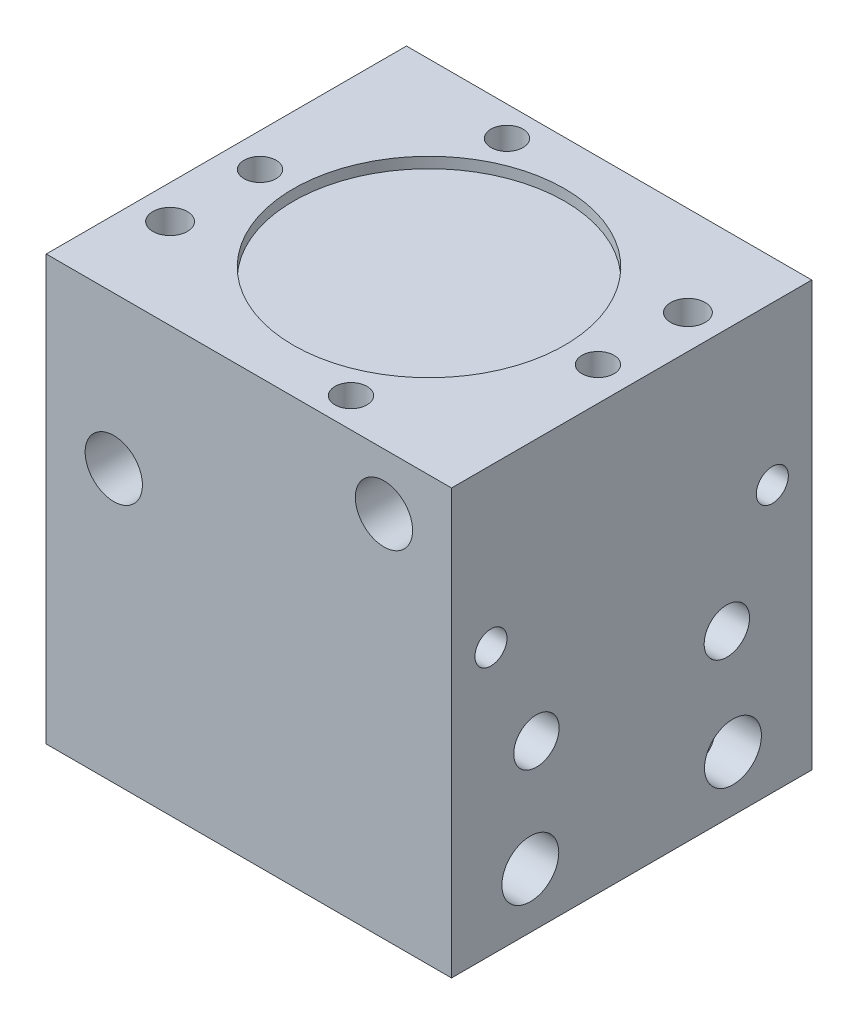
SolidWorks part; units mm, degrees
ref_plane "Front/Back" through (0, 0, 0) normal (0, 0, 1) x (1, 0, 0)
ref_plane "Top/Bottom" through (0, 0, 0) normal (0, 1, 0) x (1, 0, 0)
ref_plane "Right/Left" through (0, 0, 0) normal (1, 0, 0) x (0, 0, -1)
sketch "Sketch1" plane through (0, 0, 0) normal (0, 1, 0) x (1, 0, 0)
  line L0 (0, 0) -> (14.2875, 0) construction
  line L1 (-14.2875, 12.7) -> (14.2875, 12.7)
  line L2 (-14.2875, 12.7) -> (-14.2875, -12.7)
  line L3 (-14.2875, -12.7) -> (14.2875, -12.7)
  line L4 (14.2875, 12.7) -> (14.2875, -12.7)
  line L5 (0, 0) -> (0, 12.7) construction
  dimension "D1" = 28.575
  dimension "D2" = 25.4
extrude "Extrude1" add sketch "Sketch1" along normal mid plane 29.9212
sketch "Sketch2" plane through (0, -14.9606, 0) normal (0, -1, 0) x (1, 0, 0)
  line L0 (0, 0) -> (13.4137, 0) construction
  line L1 (0, 0) -> (0, 15.0178) construction
  line L2 (-11.1252, 6.1831) -> (-11.1252, -6.1831)
  line L3 (9.271, 10.0584) -> (-9.271, 10.0584)
  line L5 (9.271, -10.0584) -> (-9.271, -10.0584)
  line L6 (11.1252, 6.1831) -> (11.1252, -6.1831)
  arc A0 (-9.271, 10.0584) -> (-11.1252, 6.1831) centre (-9.271, 7.6772) ccw
  arc A1 (9.271, 10.0584) -> (11.1252, 6.1831) centre (9.271, 7.6772) cw
  arc A2 (-9.271, -10.0584) -> (-11.1252, -6.1831) centre (-9.271, -7.6772) cw
  arc A3 (9.271, -10.0584) -> (11.1252, -6.1831) centre (9.271, -7.6772) ccw
  dimension "D3" = 4.7625
  dimension "D4" = 20.1168
  dimension "D1" = 22.2504
  dimension "D2" = 1.8542
extrude "Cut-Extrude1" cut sketch "Sketch2" against normal blind 14.0462
sketch "Sketch3" plane through (0, 14.9606, 0) normal (0, 1, 0) x (-1, 0, 0)
  line L0 (0, 0) -> (0, 17.5227) construction
  line L1 (0, 0) -> (15.195, 0) construction
  circle A0 centre (0, 0) radius 9.5631
  dimension "D1" = 19.1262
extrude "Cut-Extrude2" cut sketch "Sketch3" against normal blind 0.762
sketch "Sketch4" plane through (14.2875, 0, 0) normal (1, 0, 0) x (0, 0, -1)
  line L0 (0, 0) -> (15.8835, 0) construction
  line L1 (0, 0) -> (0, 15.9109) construction
  line L2 (0, 14.1986) -> (0, 14.9606) construction
  line L3 (-12.7, 14.9606) -> (12.7, 14.9606) construction
  circle A0 centre (-6.7132, -3.4798) radius 1.6002
  circle A1 centre (-7.1437, -11.0744) radius 2.0066
  circle A2 centre (7.1437, -11.0744) radius 2.0066
  circle A3 centre (6.7132, -3.4798) radius 1.6002
  dimension "D1" = 3.2004
  dimension "D2" = 4.0132
  dimension "D5" = 18.4404
  dimension "D6" = 26.035
  dimension "D3" = 6.7132
  dimension "D4" = 7.1437
extrude "Cut-Extrude3" cut sketch "Sketch4" against normal through all
hole_wizard "#4-40 (Sensor Block Mount)" positions "Sketch7" profile "Sketch6" tap size "#4-40" standard "Ansi Inch"
sketch "Sketch7" plane through (14.2875, 0, 0) normal (1, 0, 0) x (0, 0, -1)
  line L0 (0, 0) -> (0, 13.6105) construction
  line L1 (0, 14.1986) -> (0, 14.9606) construction
  line L2 (0, 0) -> (14.8428, 0) construction
  line L3 (-12.7, 14.9606) -> (12.7, 14.9606) construction
  point P0 (-9.9187, 3.8354)
  point P1 (9.9187, 3.8354)
  dimension "D1" = 19.8374
  dimension "D2" = 11.1252
sketch "Sketch6" plane through (14.2875, 3.8354, 9.9187) normal (0, 1, 0) x (0, 0, -1)
  line L0 (0, 0) -> (0, 11.779)
  line L1 (0, 11.779) -> (1.1303, 11.0998)
  line L2 (1.1303, 11.0998) -> (1.1303, 0)
  line L5 (1.1303, 0) -> (0, 0)
  line L10 (0, 11.779) -> (-1.1303, 11.0998) construction
  line L11 (0, -6.35) -> (0, 107.95) construction
  dimension "Tap Drill Dia." = 2.2606
  dimension "Tap Drill Depth" = 11.0998
  dimension "Drill Angle" = 118
hole_wizard "#4-40 Tapped Hole3" positions "Sketch11" profile "Sketch10" tap size "#4-40" standard "ANSI Inch"
sketch "Sketch11" plane through (0, 0, -12.7) normal (0, 0, -1) x (-1, 0, 0)
  line L0 (0, 0) -> (0, 15.8013) construction
  line L1 (0, 0) -> (15.8835, 0) construction
  line L2 (-14.2875, 14.9606) -> (14.2875, 14.9606) construction
  point P0 (-11.1125, 0.6731)
  point P1 (11.1125, 0.6731)
  dimension "D1" = 14.2875
  dimension "D2" = 22.225
sketch "Sketch10" plane through (11.1125, 0.6731, -12.7) normal (1, 0, 0) x (0, 1, 0)
  line L0 (0, 0) -> (0, 10.2042)
  line L1 (0, 10.2042) -> (1.1303, 9.525)
  line L2 (1.1303, 9.525) -> (1.1303, 0)
  line L5 (1.1303, 0) -> (0, 0)
  line L10 (0, 10.2042) -> (-1.1303, 9.525) construction
  line L11 (0, -6.35) -> (0, 107.95) construction
  dimension "Tap Drill Dia." = 2.2606
  dimension "Tap Drill Depth" = 9.525
  dimension "Drill Angle" = 118
sketch "Sketch13" plane through (0, 0, -12.7) normal (0, 0, -1) x (-1, 0, 0)
  line L0 (0, 0) -> (0, 27.9484) construction
  line L1 (0, 0) -> (19.8671, 0) construction
  line L2 (-14.2875, 14.9606) -> (14.2875, 14.9606) construction
  circle A0 centre (-11.1125, 10.1854) radius 1.2256
  circle A1 centre (11.1125, 10.1854) radius 1.2256
  dimension "D1" = 2.4511
  dimension "D3" = 22.225
  dimension "D2" = 4.7752
extrude "(3/32 Dowel Holes - Slip Fit )" cut sketch "Sketch13" against normal blind 3.175
hole_wizard "#4-40 (Mount Holes)" positions "Sketch15" profile "Sketch14" tap size "#4-40" standard "ANSI Inch"
sketch "Sketch15" plane through (0, 14.9606, 0) normal (0, 1, 0) x (-1, 0, 0)
  line L0 (0, 0) -> (15.3897, 0) construction
  line L1 (0, 0) -> (0, 13.5067) construction
  point P0 (5.1054, -10.6045)
  point P1 (11.9126, 0)
  point P2 (-5.1054, 10.6045)
  point P3 (-11.9126, 0)
  dimension "D1" = 23.8252
  dimension "D2" = 5.1054
  dimension "D3" = 10.6045
  dimension "D4" = 10.6045
  dimension "D5" = 5.1054
  dimension "D6" = 21.209
sketch "Sketch14" plane through (-5.1054, 14.9606, -10.6045) normal (1, 0, 0) x (0, 0, 1)
  line L0 (0, 0) -> (0, 14.9794)
  line L1 (0, 14.9794) -> (1.1303, 14.3002)
  line L2 (1.1303, 14.3002) -> (1.1303, 0)
  line L5 (1.1303, 0) -> (0, 0)
  line L10 (0, 14.9794) -> (-1.1303, 14.3002) construction
  line L11 (0, -6.35) -> (0, 107.95) construction
  dimension "Tap Drill Dia." = 2.2606
  dimension "Tap Drill Depth" = 14.3002
  dimension "Drill Angle" = 118
sketch "Sketch16" plane through (0, 14.9606, 0) normal (0, 1, 0) x (-1, 0, 0)
  line L0 (0, 0) -> (0, 13.2277) construction
  line L1 (0, 0) -> (16.3196, 0) construction
  circle A0 centre (11.9062, 6.35) radius 1.2192
  circle A1 centre (-11.9062, -6.35) radius 1.2192
  dimension "D1" = 2.4384
  dimension "D2" = 6.35
  dimension "D6" = 23.8125
  dimension "D3" = 11.9062
  dimension "D4" = 11.9062
  dimension "D5" = 6.35
extrude "(3/32 Dowel Holes - Slip Fit)" cut sketch "Sketch16" against normal blind 6.35
hole_wizard "#10-32 Tapped Hole1 (Air Ports)" positions "Sketch19" profile "Sketch18" tap size "#10-32" standard "ANSI Inch"
sketch "Sketch19" plane through (0, 0, 12.7) normal (0, 0, 1) x (1, 0, 0)
  line L0 (0, 0) -> (16.4312, 0) construction
  line L1 (0, 0) -> (0, 15.7466) construction
  line L2 (0, 14.1986) -> (0, 14.9606) construction
  line L3 (-14.2875, 14.9606) -> (14.2875, 14.9606) construction
  point P0 (-9.525, 4.2418)
  point P1 (9.525, 10.9982)
  dimension "D1" = 3.9624
  dimension "D2" = 10.7188
  dimension "D3" = 9.525
  dimension "D4" = 19.05
sketch "Sketch18" plane through (-9.525, 4.2418, 12.7) normal (1, 0, 0) x (0, -1, 0)
  line L0 (0, 0) -> (0, 9.2397)
  line L1 (0, 9.2397) -> (2.0193, 8.0264)
  line L2 (2.0193, 8.0264) -> (2.0193, 0)
  line L5 (2.0193, 0) -> (0, 0)
  line L10 (0, 9.2397) -> (-2.0193, 8.0264) construction
  line L11 (0, -6.35) -> (0, 107.95) construction
  dimension "Tap Drill Dia." = 4.0386
  dimension "Tap Drill Depth" = 8.0264
  dimension "Drill Angle" = 118
